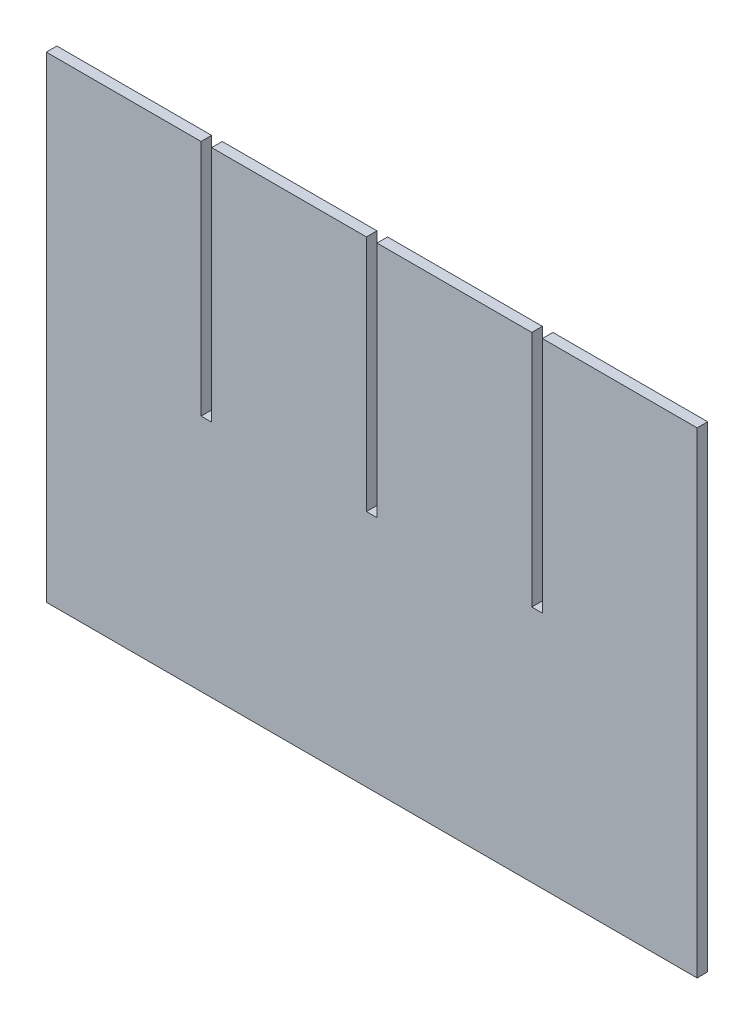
SolidWorks part; units mm, degrees
ref_plane "Front Plane" through (0, 0, 0) normal (0, 0, 1) x (1, 0, 0)
ref_plane "Top Plane" through (0, 0, 0) normal (0, 1, 0) x (1, 0, 0)
ref_plane "Right Plane" through (0, 0, 0) normal (1, 0, 0) x (0, 0, -1)
sketch "Sketch1" plane through (0, 0, 0) normal (0, 0, 1) x (1, 0, 0)
  line L0 (218.948, 160.274) -> (218.948, 0)
  line L1 (0, 0) -> (0, 160.274)
  line L2 (0, 160.274) -> (52.07, 160.274)
  line L3 (52.07, 160.274) -> (52.07, 80.264)
  line L4 (52.07, 80.264) -> (55.626, 80.264)
  line L5 (55.626, 80.264) -> (55.626, 160.274)
  line L6 (55.626, 160.274) -> (107.696, 160.274)
  line L7 (107.696, 160.274) -> (107.696, 80.264)
  line L8 (107.696, 80.264) -> (111.252, 80.264)
  line L9 (111.252, 80.264) -> (111.252, 160.274)
  line L10 (111.252, 160.274) -> (163.322, 160.274)
  line L11 (163.322, 160.274) -> (163.322, 80.264)
  line L12 (163.322, 80.264) -> (166.878, 80.264)
  line L13 (166.878, 80.264) -> (166.878, 160.274)
  line L14 (166.878, 160.274) -> (218.948, 160.274)
  line L15 (218.948, 0) -> (0, 0)
  dimension "D1" = 160.274
  dimension "D2" = 160.274
  dimension "D3" = 52.07
  dimension "D4" = 80.01
  dimension "D5" = 3.556
  dimension "D6" = 80.01
  dimension "D7" = 218.948
extrude "Boss-Extrude1" add sketch "Sketch1" along normal blind 3.556
